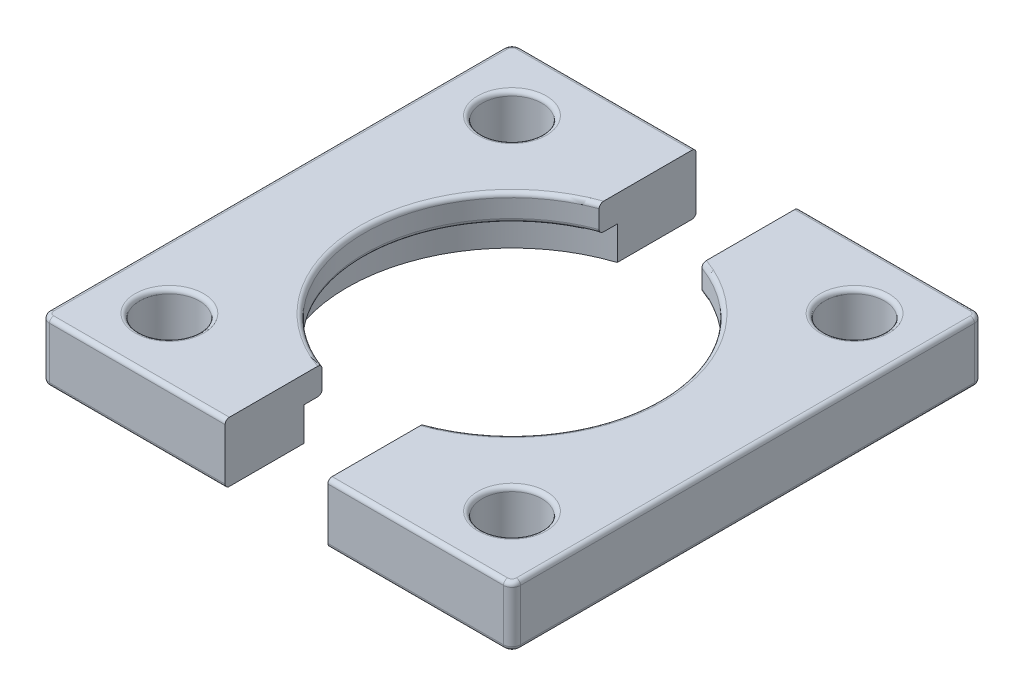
SolidWorks part; units mm, degrees
ref_plane "Front Plane" through (0, 0, 0) normal (0, 0, 1) x (1, 0, 0)
ref_plane "Top Plane" through (0, 0, 0) normal (0, 1, 0) x (1, 0, 0)
ref_plane "Right Plane" through (0, 0, 0) normal (1, 0, 0) x (0, 0, -1)
sketch "Sketch1" plane through (0, 0, 0) normal (0, 1, 0) x (1, 0, 0)
  line L0 (-17.25, 0) -> (17.25, 0) construction
  line L1 (0, 17.25) -> (0, -17.25) construction
  line L2 (-6, 27.5) -> (-6, 16.1729)
  line L3 (-26.5, 27.5) -> (-6, 27.5)
  line L4 (-27.5, 26.5) -> (-27.5, -26.5)
  line L5 (-26.5, -27.5) -> (-6, -27.5)
  line L6 (27.5, 26.5) -> (27.5, -26.5)
  line L7 (6, -27.5) -> (6, -16.1729)
  line L8 (-6, -16.1729) -> (-6, -27.5)
  line L9 (6, 16.1729) -> (6, 27.5)
  line L10 (6, 27.5) -> (26.5, 27.5)
  line L11 (6, -27.5) -> (26.5, -27.5)
  arc A0 (-6, 16.1729) -> (-6, -16.1729) centre (0, 0) ccw
  circle A1 centre (-20, 20) radius 3.5
  circle A2 centre (20, 20) radius 3.5
  circle A3 centre (20, -20) radius 3.5
  circle A4 centre (-20, -20) radius 3.5
  arc A5 (-27.5, -26.5) -> (-26.5, -27.5) centre (-26.5, -26.5) ccw
  arc A6 (26.5, -27.5) -> (27.5, -26.5) centre (26.5, -26.5) ccw
  arc A7 (26.5, 27.5) -> (27.5, 26.5) centre (26.5, 26.5) cw
  arc A8 (-26.5, 27.5) -> (-27.5, 26.5) centre (-26.5, 26.5) ccw
  arc A9 (6, -16.1729) -> (6, 16.1729) centre (0, 0) ccw
  point P23 (27.5, -27.5)
  point P26 (27.5, 27.5)
  dimension "D1" = 34.5
  dimension "D6" = 7
  dimension "D9" = 1
  dimension "D2" = 55
  dimension "D3" = 55
  dimension "D4" = 27.5
  dimension "D5" = 27.5
  dimension "D7" = 40
  dimension "D8" = 40
  dimension "D11" = 6
extrude "Boss-Extrude1" add sketch "Sketch1" along normal blind 7
sketch "Sketch2" plane through (0, 0, 0) normal (0, -1, 0) x (1, 0, 0)
  circle A0 centre (0, 0) radius 19.25
  dimension "D1" = 38.5
extrude "Cut-Extrude1" cut sketch "Sketch2" against normal blind 3.9
fillet "Fillet1" radius 0.5 14 edges at (-16.25, 0, -27.5) (-27.2071, 0, -27.2071) (-27.5, 0, 0) (-27.2071, 0, 27.2071) (-16.25, 7, -27.5) (-27.2071, 7, -27.2071) (-16.25, 7, 27.5) (-27.2071, 7, 27.2071) (-16.25, 0, 27.5) (-17.25, 3.9, 0) (-17.25, 7, 0) (-27.5, 7, 0) (-20, 7, -16.5) (-20, 7, 16.5)
fillet "Fillet2" radius 0.5 14 edges at (16.25, 0, 27.5) (27.2071, 0, 27.2071) (16.25, 0, -27.5) (27.2071, 0, -27.2071) (16.25, 7, -27.5) (27.2071, 7, -27.2071) (27.5, 7, 0) (27.2071, 7, 27.2071) (27.5, 0, 0) (16.25, 7, 27.5) (17.25, 3.9, 0) (17.25, 7, 0) (20, 7, 23.5) (20, 7, -23.5)
